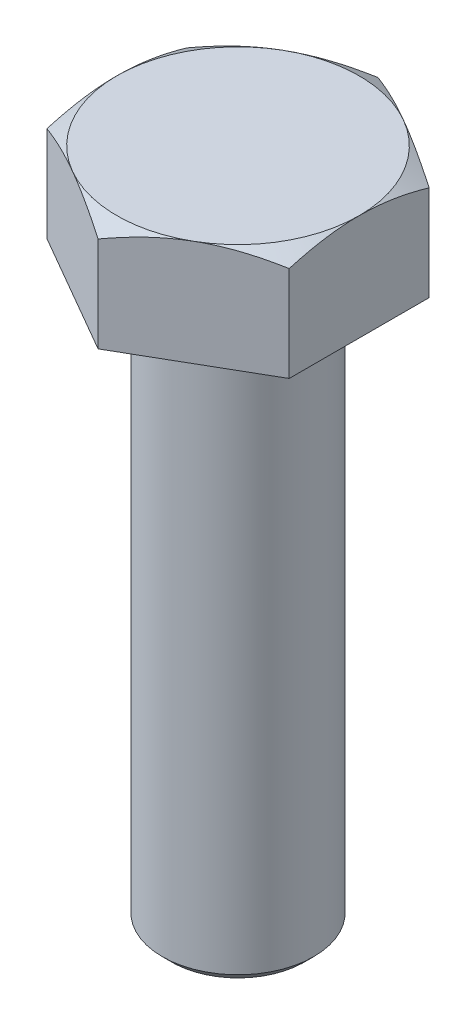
SolidWorks part; units mm, degrees
ref_plane "Front" through (0, 0, 0) normal (0, 0, 1) x (1, 0, 0)
ref_plane "Top" through (0, 0, 0) normal (0, 1, 0) x (1, 0, 0)
ref_plane "Right" through (0, 0, 0) normal (1, 0, 0) x (0, 0, -1)
sketch "Sketch1" plane through (0, 0, 0) normal (0, 1, 0) x (1, 0, 0)
  line L1 (0, 14.7802) -> (-12.8, 7.3901)
  line L2 (-12.8, 7.3901) -> (-12.8, -7.3901)
  line L3 (-12.8, -7.3901) -> (0, -14.7802)
  line L4 (0, -14.7802) -> (12.8, -7.3901)
  line L5 (12.8, -7.3901) -> (12.8, 7.3901)
  line L6 (12.8, 7.3901) -> (0, 14.7802)
  circle A0 centre (0, 0) radius 12.8 construction
  dimension "D1" = 25.6
extrude "Boss-Extrude1" add sketch "Sketch1" along normal blind 11.2
sketch "Sketch2" plane through (0, 0, 0) normal (0, -1, 0) x (1, 0, 0)
  circle A0 centre (0, 0) radius 8
  dimension "D1" = 16
extrude "Boss-Extrude2" add sketch "Sketch2" along normal blind 60
sketch "Sketch3" plane through (0, 11.2, 0) normal (0, 1, 0) x (1, 0, 0)
  line L0 (12.8, 7.3901) -> (0, 14.7802) construction
  circle A0 centre (0, 0) radius 12.8
extrude "Cut-Extrude1" cut sketch "Sketch3" against normal blind 68 draft 60 flip side to cut
sketch "Sketch4" plane through (0, -60, 0) normal (0, -1, 0) x (1, 0, 0)
  circle A0 centre (0, 0) radius 7
  dimension "D1" = 14
extrude "Cut-Extrude2" cut sketch "Sketch4" against normal blind 68 draft 45 flip side to cut
